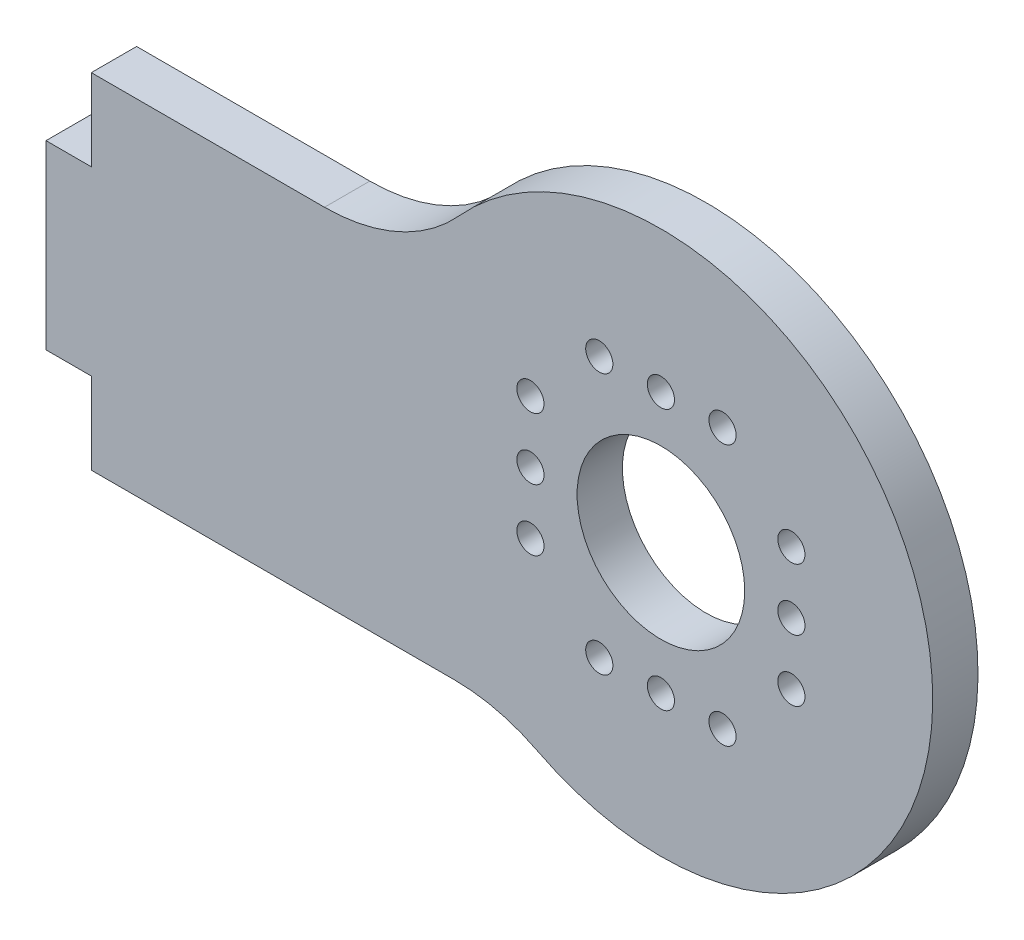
SolidWorks part; units mm, degrees
ref_plane "Front Plane" through (0, 0, 0) normal (0, 0, 1) x (1, 0, 0)
ref_plane "Top Plane" through (0, 0, 0) normal (0, 1, 0) x (1, 0, 0)
ref_plane "Right Plane" through (0, 0, 0) normal (1, 0, 0) x (0, 0, -1)
sketch "Sketch2" plane through (0, 0, 0) normal (0, 0, 1) x (1, 0, 0)
  line L0 (-31.4318, -7.7555) -> (-31.4318, -12.2555)
  line L1 (-18.564, 6.7445) -> (-31.4318, 6.7445)
  line L3 (-11.3884, -12.2555) -> (-31.4318, -12.2555)
  line L4 (-31.4318, 6.7445) -> (-31.4318, 2.2445)
  line L5 (-31.4318, 2.2445) -> (-33.9318, 2.2445)
  line L7 (-31.4318, -7.7555) -> (-33.9318, -7.7555)
  line L8 (-33.9318, 2.2445) -> (-33.9318, -7.7555)
  arc A0 (-6.833, -13.3533) -> (-11.1384, 10.0467) centre (0, 0) ccw
  circle A41 centre (0, -7.2) radius 0.75
  circle A42 centre (-7.2, 0) radius 0.75
  circle A43 centre (7.2, 0) radius 0.75
  circle A44 centre (0, 7.2) radius 0.75
  circle A53 centre (3.4, -7.2) radius 0.75
  circle A54 centre (-3.4, -7.2) radius 0.75
  circle A55 centre (-7.2, -3.4) radius 0.75
  circle A56 centre (-7.2, 3.4) radius 0.75
  circle A57 centre (-3.4, 7.2) radius 0.75
  circle A58 centre (3.4, 7.2) radius 0.75
  circle A59 centre (7.2, 3.4) radius 0.75
  circle A60 centre (7.2, -3.4) radius 0.75
  circle A62 centre (0, 0) radius 4.625
  arc A63 (-18.564, 6.7445) -> (-11.1384, 10.0467) centre (-18.564, 16.7445) ccw
  arc A64 (-6.833, -13.3533) -> (-11.3884, -12.2555) centre (-11.3884, -22.2555) ccw
  dimension "D1" = 9.25
  dimension "D2" = 1.5
  dimension "D3" = 15
  dimension "D7" = 3.4
  dimension "D4" = 10
  dimension "D5" = 3.4
  dimension "D6" = 7.2
  dimension "D8" = 6.833
  dimension "D9" = 7.2
  dimension "D10" = 11.1384
  dimension "D11" = 31.4318
  dimension "D12" = 33.9318
  dimension "D13" = 2.2445
  dimension "D14" = 3.4
  dimension "D15" = 7.2
  dimension "D16" = 3.4
  dimension "D17" = 7.2
extrude "Boss-Extrude1" add sketch "Sketch2" along normal blind 2.5
